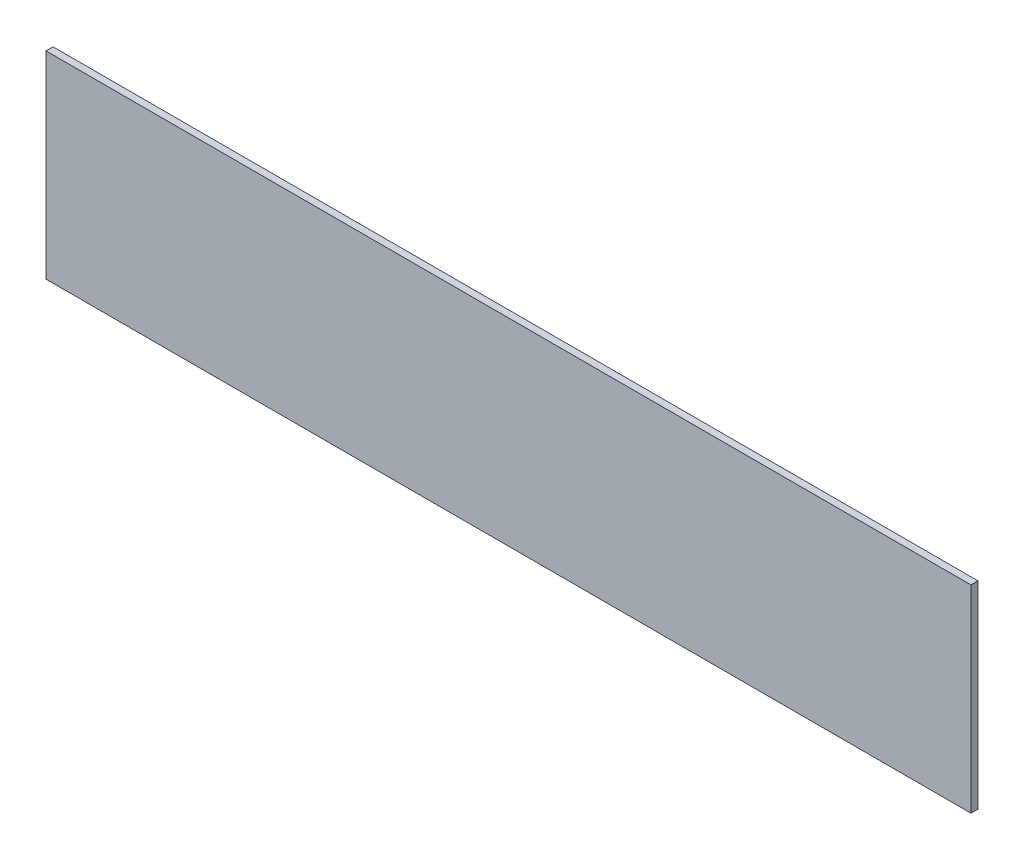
SolidWorks part; units mm, degrees
ref_plane "Front Plane" through (0, 0, 0) normal (0, 0, 1) x (1, 0, 0)
ref_plane "Top Plane" through (0, 0, 0) normal (0, 1, 0) x (1, 0, 0)
ref_plane "Right Plane" through (0, 0, 0) normal (1, 0, 0) x (0, 0, -1)
sketch "Sketch1" plane through (0, 0, 0) normal (0, 0, 1) x (1, 0, 0)
  line L1 (-207.9625, 44.45) -> (207.9625, 44.45)
  line L2 (-207.9625, 44.45) -> (-207.9625, -44.45)
  line L3 (-207.9625, -44.45) -> (207.9625, -44.45)
  line L4 (207.9625, 44.45) -> (207.9625, -44.45)
  line L5 (-207.9625, 44.45) -> (207.9625, -44.45) construction
  line L6 (-207.9625, -44.45) -> (207.9625, 44.45) construction
  point P0 (0, 0)
  dimension "D1" = 88.9
  dimension "D2" = 415.925
extrude "Boss-Extrude1" add sketch "Sketch1" along normal blind 3.175
